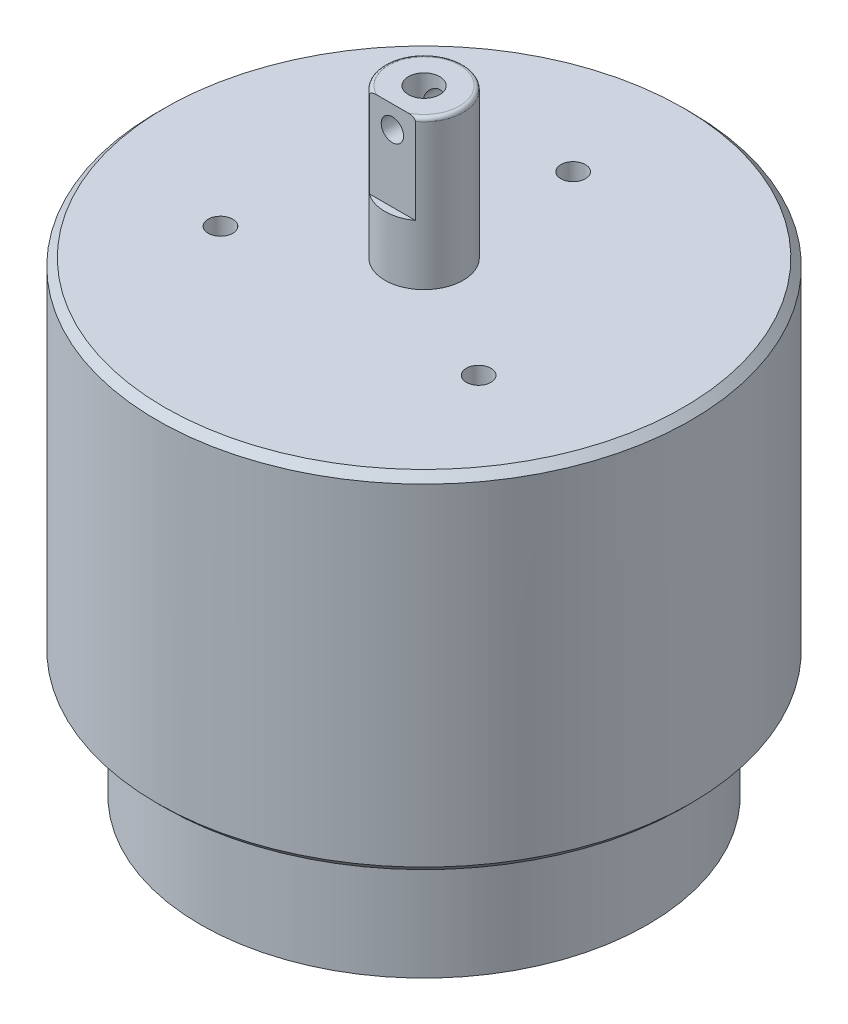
SolidWorks part; units mm, degrees
ref_plane "前视" through (0, 0, 0) normal (0, 0, 1) x (1, 0, 0)
ref_plane "上视" through (0, 0, 0) normal (0, 1, 0) x (1, 0, 0)
ref_plane "右视" through (0, 0, 0) normal (1, 0, 0) x (0, 0, -1)
sketch "草图1" plane through (0, 0, 0) normal (0, 1, 0) x (1, 0, 0)
  circle A0 centre (0, 0) radius 35.8
  dimension "D1" = 71.6
extrude "凸台-拉伸1" add sketch "草图1" along normal mid plane 46.5
sketch "草图2" plane through (0, 23.25, 0) normal (0, 1, 0) x (1, 0, 0)
  line L0 (-50.7598, 0) -> (65.2859, 0) construction
  line L1 (0, 61.6135) -> (0, -53.2896) construction
  point P5 (0, 20)
  point P6 (17.3205, -10)
  point P9 (-17.3205, -10)
  point P10 (0, 0)
  dimension "D1" = 20
  dimension "D2" = 3
hole_wizard "M4 螺纹孔1" positions "3D草图1" profile "草图3" tap size "M4" standard "Gb"
sketch3d "3D草图1"
  point P0 (0, 23.25, -20)
  point P3 (-17.3205, 23.25, 10)
  point P6 (17.3205, 23.25, 10)
sketch "草图3" plane through (0, 23.25, -20) normal (1, 0, 0) x (0, 0, 1)
  line L0 (0, 0) -> (0, 12.4914)
  line L1 (0, 12.4914) -> (1.65, 11.5)
  line L2 (1.65, 11.5) -> (1.65, 0)
  line L5 (1.65, 0) -> (0, 0)
  line L10 (0, 12.4914) -> (-1.65, 11.5) construction
  line L11 (0, -6.35) -> (0, 107.95) construction
  dimension "螺纹孔钻头直径" = 3.3
  dimension "螺纹孔钻头深度" = 11.5
  dimension "导头角度" = 118
sketch "草图4" plane through (0, 23.25, 0) normal (0, 1, 0) x (1, 0, 0)
  circle A0 centre (0, 0) radius 5.25
  dimension "D1" = 10.5
extrude "凸台-拉伸2" add sketch "草图4" along normal blind 20
fillet "圆角1" radius 0.5 1 edges at (0, 43.25, 5.25)
sketch "草图5" plane through (0, 43.25, 0) normal (0, 1, 0) x (1, 0, 0)
  line L0 (0, 61.6135) -> (0, -53.2896) construction
  line L1 (-4.814, -4.25) -> (4.814, -4.25)
  line L2 (-4.814, -4.25) -> (-4.814, -6.25)
  line L3 (-4.814, -6.25) -> (4.814, -6.25)
  line L4 (4.814, -4.25) -> (4.814, -6.25)
  line L5 (-4.814, -4.25) -> (4.814, -6.25) construction
  line L6 (-4.814, -6.25) -> (4.814, -4.25) construction
  circle A0 centre (0, 0) radius 5.25 construction
  point P0 (0, -5.25)
  dimension "D1" = 1
extrude "切除-拉伸1" cut sketch "草图5" against normal blind 12
hole_wizard "M5 螺纹孔1" positions "3D草图2" profile "草图6" tap size "M5" standard "Gb"
sketch3d "3D草图2"
  line L0 (0, 39.9163, 0) -> (0, 48.4175, 0) construction
  point P0 (0, 43.25, 0)
sketch "草图6" plane through (0, 43.25, 0) normal (1, 0, 0) x (0, 0, 1)
  line L0 (0, 0) -> (0, 15.2618)
  line L1 (0, 15.2618) -> (2.1, 14)
  line L2 (2.1, 14) -> (2.1, 0)
  line L5 (2.1, 0) -> (0, 0)
  line L10 (0, 15.2618) -> (-2.1, 14) construction
  line L11 (0, -6.35) -> (0, 107.95) construction
  dimension "螺纹孔钻头直径" = 4.2
  dimension "螺纹孔钻头深度" = 14
  dimension "导头角度" = 118
chamfer "倒角1" distance 1 angle 45 1 edges at (0, 23.25, 35.8)
sketch "草图7" plane through (0, -23.25, 0) normal (0, -1, 0) x (1, 0, 0)
  circle A0 centre (0, 0) radius 30
  dimension "D1" = 60
extrude "凸台-拉伸3" add sketch "草图7" along normal blind 17
chamfer "倒角2" distance 1 angle 45 1 edges at (0, -23.25, 35.8)
chamfer "倒角3" distance 1 distance2 3 1 edges at (0, -40.25, -30)
sketch "草图8" plane through (0, 0, 4.25) normal (0, 0, 1) x (1, 0, 0)
  line L0 (2.1213, 43.25) -> (-2.1213, 43.25) construction
  circle A0 centre (0, 40.25) radius 1.5
  dimension "D1" = 3
  dimension "D2" = 3
extrude "切除-拉伸2" cut sketch "草图8" against normal through all
sketch "草图9" plane through (0, 23.25, 0) normal (0, 1, 0) x (1, 0, 0)
  arc A0 (3.0822, -4.25) -> (-3.0822, -4.25) centre (0, 0) ccw construction
  circle A1 centre (17.3205, -10) radius 1.65 construction
  circle A2 centre (-17.3205, -10) radius 1.65 construction
  circle A3 centre (0, 20) radius 1.65 construction
  arc A4 (3.0822, -4.25) -> (-3.0822, -4.25) centre (0, 0) ccw
  circle A5 centre (17.3205, -10) radius 1.65
  circle A6 centre (-17.3205, -10) radius 1.65
  circle A7 centre (0, 20) radius 1.65
